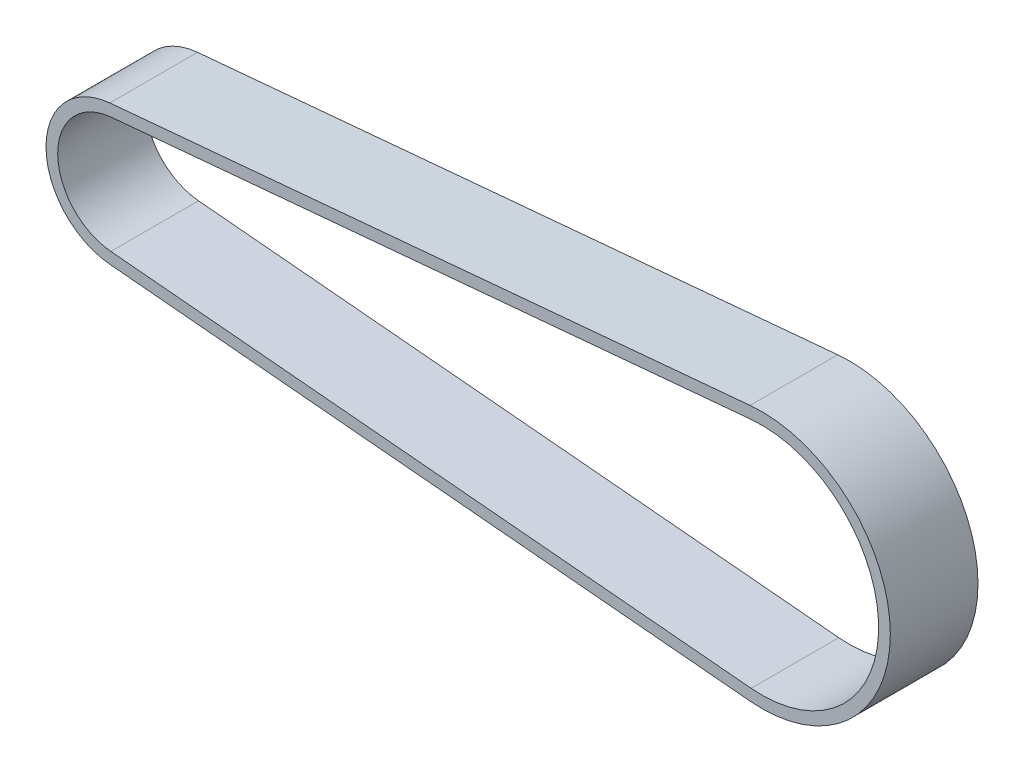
SolidWorks part; units mm, degrees
ref_plane "Plan de face" through (0, 0, 0) normal (0, 0, 1) x (1, 0, 0)
ref_plane "Plan de dessus" through (0, 0, 0) normal (0, 1, 0) x (1, 0, 0)
ref_plane "Plan de droite" through (0, 0, 0) normal (1, 0, 0) x (0, 0, -1)
sketch "Esquisse1" plane through (0, 0, 0) normal (0, 0, 1) x (1, 0, 0)
  line L0 (-0.9055, 9.9589) -> (108.6259, 19.9178)
  line L1 (-0.9055, -9.9589) -> (108.6259, -19.9178)
  arc A0 (-0.9055, 9.9589) -> (-0.9055, -9.9589) centre (0, 0) ccw
  arc A1 (108.6259, -19.9178) -> (108.6259, 19.9178) centre (110.4369, 0) ccw
  dimension "D1" = 10
  dimension "D2" = 20
  dimension "D3" = 110.4369
extrude "Extru.-Mince1" add sketch "Esquisse1" along normal blind 15 thin
